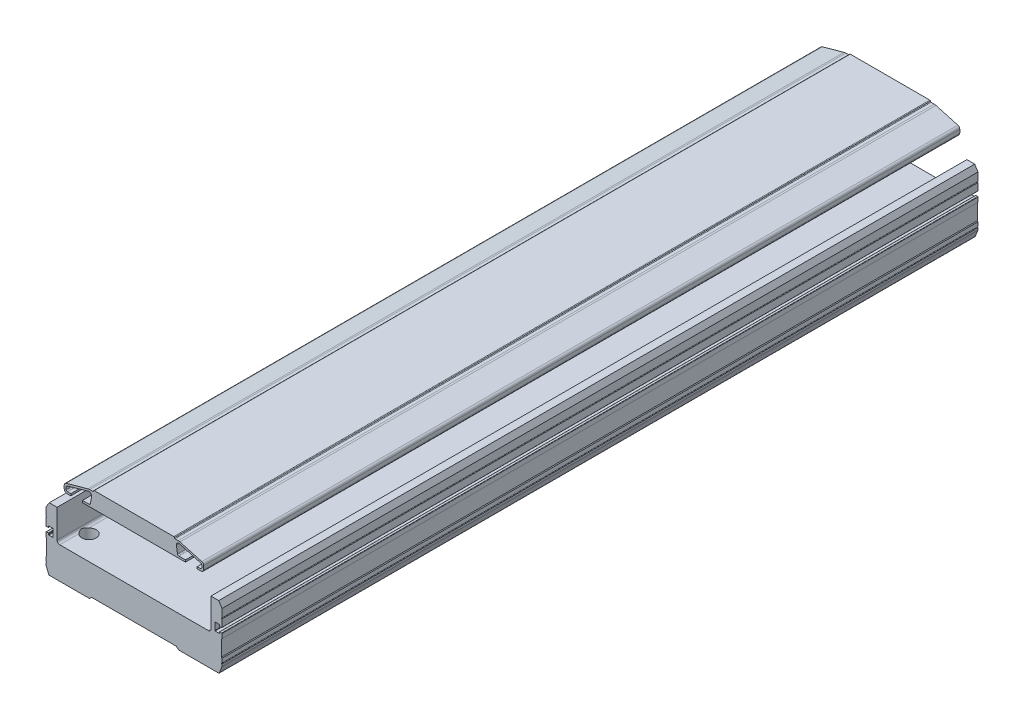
SolidWorks part; units mm, degrees
ref_plane "前视基准面" through (0, 0, 0) normal (0, 0, 1) x (1, 0, 0)
ref_plane "上视基准面" through (0, 0, 0) normal (0, 1, 0) x (1, 0, 0)
ref_plane "右视基准面" through (0, 0, 0) normal (1, 0, 0) x (0, 0, -1)
sketch "草图1" plane through (0, 0, 0) normal (0, 0, 1) x (1, 0, 0)
  line B0 (-51.5, 59.4) -> (-48.5, 59.4)
  line B1 (-48.5, 59.4) -> (-48.5, 60.9)
  line B2 (-48.5, 60.9) -> (-51, 60.9)
  line B3 (-52, 61.9) -> (-52, 63.7046)
  line B4 (-51.27, 64.6675) -> (-35.0485, 69.2164)
  line B5 (-32.5361, 66.9593) -> (-33.4138, 61.7343)
  line B6 (-34.4, 60.9) -> (-39.5, 60.9)
  line B7 (-39.5, 60.9) -> (-39.5, 59.4)
  line B8 (-39.5, 59.4) -> (39.5, 59.4)
  line B9 (39.5, 59.4) -> (39.5, 60.9)
  line B10 (39.5, 60.9) -> (34.4, 60.9)
  line B11 (33.4138, 61.7343) -> (32.5361, 66.9593)
  line B12 (35.0485, 69.2164) -> (51.27, 64.6675)
  line B13 (52, 63.7046) -> (52, 61.9)
  line B14 (51, 60.9) -> (48.5, 60.9)
  line B15 (48.5, 60.9) -> (48.5, 59.4)
  line B16 (48.5, 59.4) -> (51.5, 59.4)
  line B17 (53.5, 61.4) -> (53.5, 64.0837)
  line B18 (52.04, 66.0094) -> (35.2622, 70.7143)
  line B19 (33.9122, 70.9) -> (31.5, 70.9)
  line B20 (30.5, 71.9) -> (-30.5, 71.9)
  line B21 (-31.5, 70.9) -> (-33.9122, 70.9)
  line B22 (-35.2622, 70.7143) -> (-52.04, 66.0094)
  line B23 (-53.5, 64.0837) -> (-53.5, 61.4)
  line B24 (-65.16, -1.6) -> (-34.1, -1.6)
  line B25 (-34.1, -1.6) -> (-32.5, 0)
  line B26 (-32.5, 0) -> (32.5, 0)
  line B27 (32.5, 0) -> (34.1, -1.6)
  line B28 (34.1, -1.6) -> (65.16, -1.6)
  line B29 (65.5064, -1.0289) -> (67.36, 3.6468)
  line B30 (67.5, 4.3812) -> (67.5, 5.625)
  line B31 (67.5, 6.375) -> (67.5, 9.5)
  line B32 (67.5, 9.5) -> (67, 10)
  line B33 (67, 10) -> (67, 22)
  line B34 (67, 22) -> (67.5, 22.5)
  line B35 (67.5, 22.5) -> (67.5, 25.9)
  line B36 (67.2, 26.2) -> (65.8, 26.2)
  line B37 (65.5, 25.9) -> (65.5, 25.3)
  line B38 (65.2, 25) -> (62.3, 25)
  line B39 (62, 25.3) -> (62, 30.7)
  line B40 (62.3, 31) -> (65.2, 31)
  line B41 (65.5, 30.7) -> (65.5, 30.1)
  line B42 (65.8, 29.8) -> (67.2, 29.8)
  line B43 (67.5, 30.1) -> (67.5, 35.625)
  line B44 (67.5, 36.375) -> (67.5, 42.6)
  line B45 (67.5, 42.6) -> (65, 46.6)
  line B46 (65, 46.6) -> (59, 46.6)
  line B47 (59, 46.6) -> (59, 24.7)
  line B48 (57, 22.7) -> (-57, 22.7)
  line B49 (-59, 24.7) -> (-59, 46.6)
  line B50 (-59, 46.6) -> (-65, 46.6)
  line B51 (-65, 46.6) -> (-67.5, 42.6)
  line B52 (-67.5, 42.6) -> (-67.5, 36.375)
  line B53 (-67.5, 35.625) -> (-67.5, 30.1)
  line B54 (-67.2, 29.8) -> (-65.8, 29.8)
  line B55 (-65.5, 30.1) -> (-65.5, 30.7)
  line B56 (-65.2, 31) -> (-62.3, 31)
  line B57 (-62, 30.7) -> (-62, 25.3)
  line B58 (-62.3, 25) -> (-65.2, 25)
  line B59 (-65.5, 25.3) -> (-65.5, 25.9)
  line B60 (-65.8, 26.2) -> (-67.2, 26.2)
  line B61 (-67.5, 25.9) -> (-67.5, 22.5)
  line B62 (-67.5, 22.5) -> (-67, 22)
  line B63 (-67, 22) -> (-67, 10)
  line B64 (-67, 10) -> (-67.5, 9.5)
  line B65 (-67.5, 9.5) -> (-67.5, 6.375)
  line B66 (-67.5, 5.625) -> (-67.5, 4.3812)
  line B67 (-67.36, 3.6468) -> (-65.5064, -1.0289)
  arc B68 (-53.5, 61.4) -> (-51.5, 59.4) centre (-51.5, 61.4) ccw
  arc B69 (-52, 61.9) -> (-51, 60.9) centre (-51, 61.9) ccw
  arc B70 (-51.27, 64.6675) -> (-52, 63.7046) centre (-51, 63.7046) ccw
  arc B71 (-32.5361, 66.9593) -> (-35.0485, 69.2164) centre (-34.5085, 67.2906) ccw
  arc B72 (-34.4, 60.9) -> (-33.4138, 61.7343) centre (-34.4, 61.9) ccw
  arc B73 (33.4138, 61.7343) -> (34.4, 60.9) centre (34.4, 61.9) ccw
  arc B74 (35.0485, 69.2164) -> (32.5361, 66.9593) centre (34.5085, 67.2906) ccw
  arc B75 (52, 63.7046) -> (51.27, 64.6675) centre (51, 63.7046) ccw
  arc B76 (51, 60.9) -> (52, 61.9) centre (51, 61.9) ccw
  arc B77 (51.5, 59.4) -> (53.5, 61.4) centre (51.5, 61.4) ccw
  arc B78 (53.5, 64.0837) -> (52.04, 66.0094) centre (51.5, 64.0837) ccw
  arc B79 (35.2622, 70.7143) -> (33.9122, 70.9) centre (33.9122, 65.9) ccw
  arc B80 (31, 71.4) -> (31.5, 70.9) centre (31.5, 71.4) ccw
  arc B81 (31, 71.4) -> (30.5, 71.9) centre (30.5, 71.4) ccw
  arc B82 (-30.5, 71.9) -> (-31, 71.4) centre (-30.5, 71.4) ccw
  arc B83 (-31.5, 70.9) -> (-31, 71.4) centre (-31.5, 71.4) ccw
  arc B84 (-33.9122, 70.9) -> (-35.2622, 70.7143) centre (-33.9122, 65.9) ccw
  arc B85 (-52.04, 66.0094) -> (-53.5, 64.0837) centre (-51.5, 64.0837) ccw
  arc B86 (-65.5064, -1.0289) -> (-65.16, -1.6) centre (-63.6472, -0.2918) ccw
  arc B87 (65.16, -1.6) -> (65.5064, -1.0289) centre (63.6472, -0.2918) ccw
  arc B88 (67.36, 3.6468) -> (67.5, 4.3812) centre (65.5, 4.382) ccw
  arc B89 (67.5, 6.375) -> (67.5, 5.625) centre (67.5, 6) ccw
  arc B90 (67.5, 25.9) -> (67.2, 26.2) centre (67.2, 25.9) ccw
  arc B91 (65.8, 26.2) -> (65.5, 25.9) centre (65.8, 25.9) ccw
  arc B92 (65.2, 25) -> (65.5, 25.3) centre (65.2, 25.3) ccw
  arc B93 (62, 25.3) -> (62.3, 25) centre (62.3, 25.3) ccw
  arc B94 (62.3, 31) -> (62, 30.7) centre (62.3, 30.7) ccw
  arc B95 (65.5, 30.7) -> (65.2, 31) centre (65.2, 30.7) ccw
  arc B96 (65.5, 30.1) -> (65.8, 29.8) centre (65.8, 30.1) ccw
  arc B97 (67.2, 29.8) -> (67.5, 30.1) centre (67.2, 30.1) ccw
  arc B98 (67.5, 36.375) -> (67.5, 35.625) centre (67.5, 36) ccw
  arc B99 (57, 22.7) -> (59, 24.7) centre (57, 24.7) ccw
  arc B100 (-59, 24.7) -> (-57, 22.7) centre (-57, 24.7) ccw
  arc B101 (-67.5, 35.625) -> (-67.5, 36.375) centre (-67.5, 36) ccw
  arc B102 (-67.5, 30.1) -> (-67.2, 29.8) centre (-67.2, 30.1) ccw
  arc B103 (-65.8, 29.8) -> (-65.5, 30.1) centre (-65.8, 30.1) ccw
  arc B104 (-65.2, 31) -> (-65.5, 30.7) centre (-65.2, 30.7) ccw
  arc B105 (-62, 30.7) -> (-62.3, 31) centre (-62.3, 30.7) ccw
  arc B106 (-62.3, 25) -> (-62, 25.3) centre (-62.3, 25.3) ccw
  arc B107 (-65.5, 25.3) -> (-65.2, 25) centre (-65.2, 25.3) ccw
  arc B108 (-65.5, 25.9) -> (-65.8, 26.2) centre (-65.8, 25.9) ccw
  arc B109 (-67.2, 26.2) -> (-67.5, 25.9) centre (-67.2, 25.9) ccw
  arc B110 (-67.5, 5.625) -> (-67.5, 6.375) centre (-67.5, 6) ccw
  arc B111 (-67.5, 4.3812) -> (-67.36, 3.6468) centre (-65.5, 4.382) ccw
sketch_block_instance "块24-1"
sketch_block "块24"
extrude "凸台-拉伸1" add sketch "草图1" along normal blind 580
hole_wizard "打孔尺寸(%根据)内六角圆柱头螺钉的类型1" positions "草图7" profile "草图5" counterbore size "M6" standard "GB"
sketch "草图7" plane through (0, 46.6, 0) normal (0, 1, 0) x (1, 0, 0)
  line L0 (0, 0) -> (0, -383.8232) construction
  line L3 (-65.16, 0) -> (-34.1, 0) construction
  point P0 (-53, -61.5)
  point P8 (-53, -161.5)
  point P10 (-53, -961.5)
  point P12 (-53, -561.5)
  point P14 (-53, -361.5)
  point P16 (-53, -1161.5)
  point P18 (-53, -761.5)
  point P34 (53, -761.5)
  point P35 (53, -1161.5)
  point P36 (53, -361.5)
  point P37 (53, -561.5)
  point P38 (53, -961.5)
  point P39 (53, -161.5)
  point P40 (53, -61.5)
  dimension "D1" = 106
  dimension "D2" = 61.5
  dimension "D3" = 100
  dimension "D4" = 200
  dimension "D5" = 200
  dimension "D6" = 200
  dimension "D7" = 200
  dimension "D8" = 200
sketch "草图5" plane through (-53, 46.6, 61.5) normal (1, 0, 0) x (0, 0, 1)
  line L0 (0, 0) -> (0, 48.2)
  line L1 (0, 48.2) -> (3.5, 48.2)
  line L3 (3.5, 48.2) -> (3.5, 40.9)
  line L4 (3.5, 40.9) -> (5.5, 40.9)
  line L5 (5.5, 40.9) -> (5.5, 0)
  line L7 (5.5, 0) -> (0, 0)
  line L11 (0, -6.35) -> (0, 107.95) construction
  dimension "通孔孔直径" = 7
  dimension "通孔孔深度" = 48.2
  dimension "柱形沉头孔直径" = 11
  dimension "柱形沉头孔深度" = 40.9
hole_wizard "M6 螺纹孔1" positions "草图8" profile "草图9" tap size "M6" standard "GB"
sketch "草图8" plane through (0, -1.6, 0) normal (0, -1, 0) x (-1, 0, 0)
  line L0 (0, 0) -> (0, -43.6644) construction
  line L3 (-34.1, 0) -> (-65.16, 0) construction
  point P0 (-53, -51.5)
  point P7 (53, -51.5)
  point P10 (-53, -151.5)
  point P12 (-53, -351.5)
  point P14 (-53, -551.5)
  point P18 (-53, -751.5)
  point P20 (-53, -951.5)
  point P21 (53, -951.5)
  point P22 (53, -751.5)
  point P23 (53, -551.5)
  point P24 (53, -351.5)
  point P25 (53, -151.5)
  point P28 (-53, -1151.5)
  point P34 (53, -1151.5)
  dimension "D1" = 106
  dimension "D2" = 51.5
  dimension "D3" = 100
  dimension "D4" = 200
  dimension "D5" = 200
  dimension "D6" = 200
  dimension "D7" = 200
  dimension "D8" = 200
sketch "草图9" plane through (53, -1.6, 51.5) normal (1, 0, 0) x (0, 0, -1)
  line L0 (0, 0) -> (0, 12.5022)
  line L1 (0, 12.5022) -> (2.5, 11)
  line L2 (2.5, 11) -> (2.5, 0)
  line L5 (2.5, 0) -> (0, 0)
  line L10 (0, 12.5022) -> (-2.5, 11) construction
  line L11 (0, -6.35) -> (0, 107.95) construction
  dimension "螺纹孔钻头直径" = 5
  dimension "螺纹孔钻头深度" = 11
  dimension "导头角度" = 118
